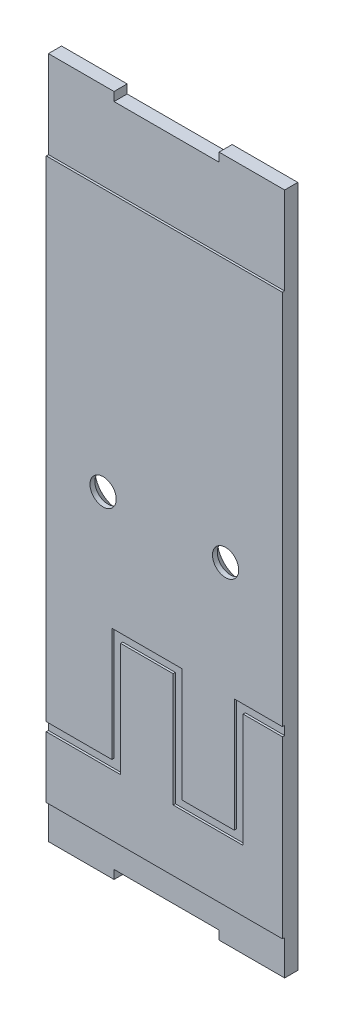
SolidWorks part; units mm, degrees
ref_plane "Спереди" through (0, 0, 0) normal (0, 0, 1) x (1, 0, 0)
ref_plane "Сверху" through (0, 0, 0) normal (0, 1, 0) x (1, 0, 0)
ref_plane "Справа" through (0, 0, 0) normal (1, 0, 0) x (0, 0, -1)
sketch "Эскиз1" plane through (0, 0, 0) normal (0, 0, 1) x (1, 0, 0)
  line L1 (0, 0) -> (27, 0)
  line L2 (0, 0) -> (0, 78)
  line L3 (0, 78) -> (27, 78)
  line L4 (27, 0) -> (27, 78)
  dimension "D1" = 27
  dimension "D2" = 78
extrude "Бобышка-Вытянуть1" add sketch "Эскиз1" along normal blind 1.5
sketch "Эскиз3" plane through (0, 0, 1.5) normal (0, 0, 1) x (1, 0, 0)
  line L4 (0, 78) -> (0, 0)
  line L5 (0, 0) -> (27, 0)
  line L6 (27, 0) -> (27, 78)
  line L7 (27, 78) -> (0, 78)
  line L8 (0, 78) -> (0, 0)
  line L9 (0, 0) -> (27, 0)
  line L10 (27, 0) -> (27, 78)
  line L11 (27, 78) -> (0, 78)
  dimension "D1" = 0
extrude "Бобышка-Вытянуть2" add sketch "Эскиз3" along normal blind 0.25
sketch "Эскиз5" plane through (0, 0, 1.75) normal (0, 0, 1) x (1, 0, 0)
  line L0 (27, 0) -> (27, 78) construction
  line L1 (0, 78) -> (27, 78)
  line L2 (0, 78) -> (0, 68)
  line L3 (0, 68) -> (27, 68)
  line L4 (27, 78) -> (27, 68)
  line L6 (0, 0) -> (27, 0)
  line L7 (0, 0) -> (0, 4)
  line L8 (0, 4) -> (27, 4)
  line L9 (27, 0) -> (27, 4)
  dimension "D1" = 10
  dimension "D2" = 4
extrude "Вырез-Вытянуть1" cut sketch "Эскиз5" against normal blind 0.25
sketch "Эскиз6" plane through (0, 0, 1.75) normal (0, 0, 1) x (1, 0, 0)
  line L0 (13.5, 78) -> (13.5, 0) construction
  line L1 (27, 78) -> (0, 78) construction
  line L2 (0, 0) -> (27, 0) construction
  circle A0 centre (20.5, 38) radius 1.5
  circle A1 centre (6.5, 38) radius 1.5
  dimension "D1" = 3
  dimension "D2" = 40
  dimension "D3" = 7
extrude "Вырез-Вытянуть2" cut sketch "Эскиз6" against normal through all
sketch "Эскиз7" plane through (0, 0, 1.75) normal (0, 0, 1) x (1, 0, 0)
  line L0 (0, 68) -> (0, 4) construction
  line L1 (21.5, 25) -> (27, 25)
  line L2 (8.5, 24) -> (8.5, 11)
  line L3 (22.5, 11) -> (14.5, 11)
  line L4 (27, 25) -> (27, 24)
  line L6 (15.5, 25) -> (7.5, 25)
  line L7 (0, 12) -> (7.5, 12)
  line L8 (7.5, 25) -> (7.5, 12)
  line L9 (15.5, 12) -> (21.5, 12)
  line L10 (15.5, 25) -> (15.5, 12)
  line L11 (22.5, 24) -> (22.5, 11)
  line L12 (8.5, 24) -> (14.5, 24)
  line L13 (21.5, 25) -> (21.5, 12)
  line L14 (22.5, 24) -> (27, 24)
  line L15 (14.5, 24) -> (14.5, 11)
  line L16 (8.5, 11) -> (0, 11)
  line L17 (0, 12) -> (0, 11)
  line L19 (27, 4) -> (27, 68) construction
  circle A0 centre (20.5, 38) radius 1.5 construction
  circle A1 centre (6.5, 38) radius 1.5 construction
  dimension "D1" = 1
  dimension "D2" = 1
  dimension "D3" = 1
  dimension "D4" = 1
  dimension "D5" = 1
  dimension "D6" = 13
  dimension "D7" = 1
  dimension "D8" = 1
  dimension "D9" = 14
extrude "Вырез-Вытянуть3" cut sketch "Эскиз7" against normal blind 0.25
sketch "Эскиз8" plane through (0, 0, 1.5) normal (0, 0, 1) x (1, 0, 0)
  line L0 (13.5, 78) -> (13.5, 0) construction
  line L1 (27, 78) -> (0, 78) construction
  line L2 (0, 0) -> (27, 0) construction
  line L4 (7.5, 78) -> (19.5, 78)
  line L5 (7.5, 78) -> (7.5, 77)
  line L6 (7.5, 77) -> (19.5, 77)
  line L7 (19.5, 78) -> (19.5, 77)
  line L8 (7.5, 0) -> (19.5, 0)
  line L9 (7.5, 0) -> (7.5, 1)
  line L10 (7.5, 1) -> (19.5, 1)
  line L11 (19.5, 0) -> (19.5, 1)
  dimension "D1" = 12
  dimension "D2" = 1
  dimension "D3" = 1
  dimension "D4" = 12
extrude "Вырез-Вытянуть4" cut sketch "Эскиз8" against normal through all
chamfer "Фаска1" distance 1.2 angle 45 2 edges at (22, 38, 0) (5, 38, 0)
